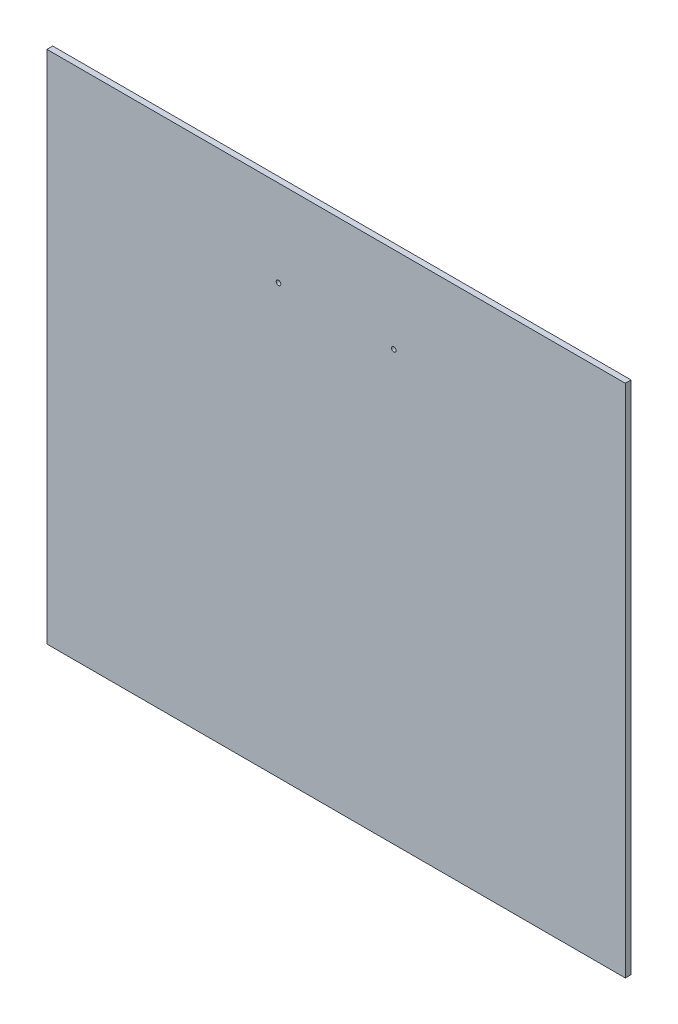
SolidWorks part; units mm, degrees
ref_plane "Спереди" through (0, 0, 0) normal (0, 0, 1) x (1, 0, 0)
ref_plane "Сверху" through (0, 0, 0) normal (0, 1, 0) x (1, 0, 0)
ref_plane "Справа" through (0, 0, 0) normal (1, 0, 0) x (0, 0, -1)
sketch "Эскиз1" plane through (0, 0, 0) normal (0, 0, 1) x (1, 0, 0)
  line L1 (-502, 0) -> (502, 0)
  line L2 (-502, 0) -> (-502, -894)
  line L3 (-502, -894) -> (502, -894)
  line L4 (502, 0) -> (502, -894)
  line L5 (0, -894) -> (0, 0) construction
  dimension "D1" = 894
  dimension "D2" = 1004
extrude "Бобышка-Вытянуть1" add sketch "Эскиз1" along normal blind 10
sketch "Эскиз2" plane through (0, 0, 10) normal (0, 0, 1) x (1, 0, 0)
  line L0 (-100, -150) -> (100, -150) construction
  line L1 (0, 0) -> (0, -150) construction
  circle A0 centre (-100, -150) radius 4
  circle A1 centre (100, -150) radius 4
  dimension "D3" = 8
  dimension "D1" = 150
  dimension "D2" = 200
extrude "Вырез-Вытянуть1" cut sketch "Эскиз2" against normal through all
